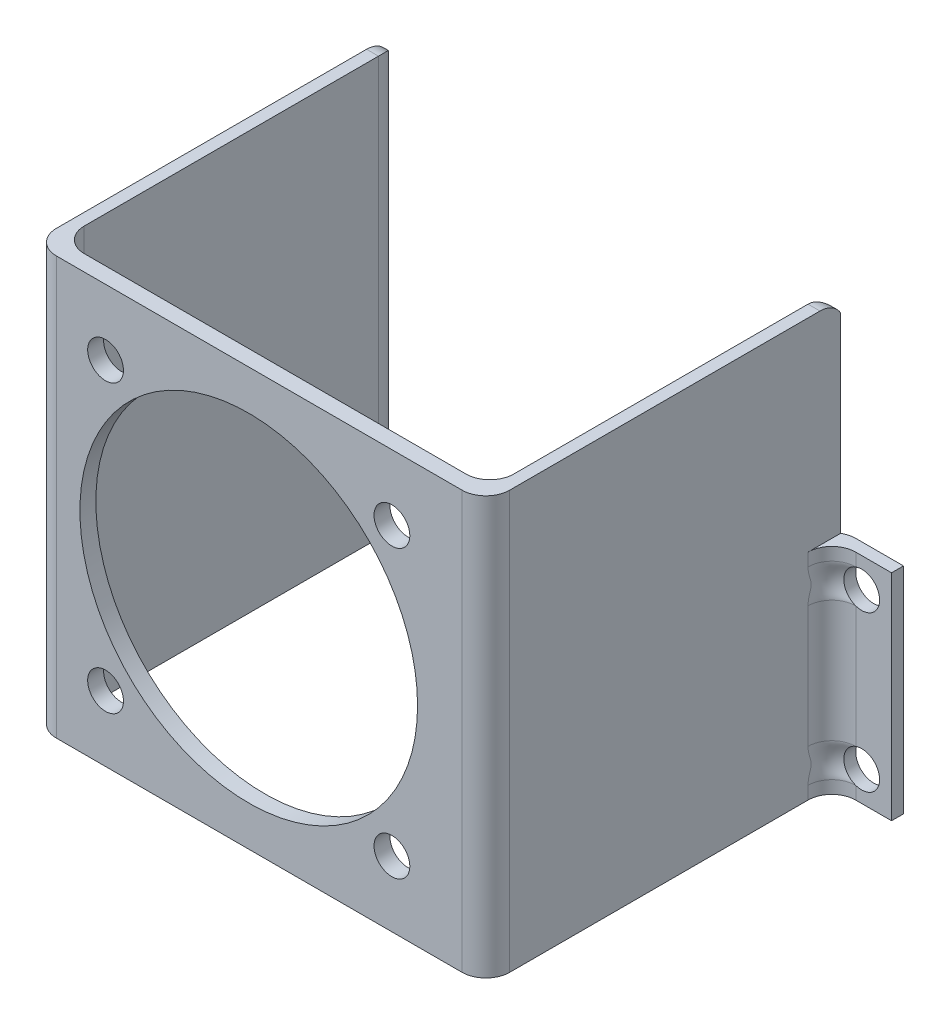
SolidWorks part; units mm, degrees
ref_plane "Front Plane" through (0, 0, 0) normal (0, 0, 1) x (1, 0, 0)
ref_plane "Top Plane" through (0, 0, 0) normal (0, 1, 0) x (1, 0, 0)
ref_plane "Right Plane" through (0, 0, 0) normal (1, 0, 0) x (0, 0, -1)
sketch "Sketch1" plane through (0, 0, 0) normal (0, 0, 1) x (1, 0, 0)
  line L0 (26, -6.514) -> (26, 6.514) construction
  line L1 (-17, -6.514) -> (-17, 6.514) construction
  line L3 (23.5, -9) -> (28.5, -9)
  line L4 (23.5, -9) -> (23.5, 9)
  line L5 (23.5, 9) -> (28.5, 9)
  line L6 (28.5, -9) -> (28.5, 9)
  line L7 (23.5, -9) -> (28.5, 9) construction
  line L8 (23.5, 9) -> (28.5, -9) construction
  line L9 (4.5, 200010.514) -> (4.5, -200005.4786)
  line L10 (-19.5, -9) -> (-19.5, 9)
  line L11 (-14.5, -9) -> (-19.5, -9)
  line L12 (-14.5, -9) -> (-14.5, 9)
  line L13 (-14.5, 9) -> (-19.5, 9)
  circle A4 centre (-17, -6.514) radius 1.5
  circle A5 centre (-17, 6.514) radius 1.5
  circle A6 centre (26, -6.514) radius 1.5
  circle A7 centre (26, 6.514) radius 1.5
  point P12 (26, 0)
  dimension "D1" = 5
  dimension "D2" = 18
extrude "Boss-Extrude1" add sketch "Sketch1" along normal blind 1
sketch "Sketch2" plane through (0, -9, 0) normal (0, 1, 0) x (1, 0, 0)
  line L0 (23.5, -1) -> (23.5, 0) construction
  line L1 (23.5, -1) -> (23.5, 0)
  line L2 (4.5, 12.0037) -> (4.5, -55.4766) construction
  line L3 (23.5, 0) -> (22.5, 0)
  line L4 (23.5, 0) -> (23.5, -30)
  line L5 (23.5, -30) -> (22.5, -30)
  line L6 (22.5, 0) -> (22.5, -28.6639)
  line L7 (22.5, -30) -> (-13.5, -30)
  line L8 (22.5, -30) -> (22.5, -28.6639) construction
  line L9 (22.5, -28.6639) -> (-13.5, -28.6639)
  line L10 (4.5, -30) -> (4.5, -28.6639)
  line L11 (-13.5, -30) -> (-13.5, -28.6639) construction
  line L12 (-13.5, 0) -> (-13.5, -28.6639)
  line L13 (-14.5, -30) -> (-13.5, -30)
  line L14 (-14.5, -1) -> (-14.5, 0) construction
  line L15 (-14.5, 0) -> (-14.5, -30)
  line L16 (-13.5, 0) -> (-14.5, 0)
  line L17 (22.5, -28.6639) -> (22.5, -30) construction
  line L18 (-13.5, -28.6639) -> (-13.5, -30) construction
  dimension "D1" = 1
  dimension "D2" = 30
extrude "Boss-Extrude2" add sketch "Sketch2" along normal blind 35 contours L3 L6 L9 L12 L16 L15 L13 L7 L5 L4
sketch "Sketch4" plane through (0, 0, 30) normal (0, 0, 1) x (1, 0, 0)
  circle A0 centre (15.625, 20.5) radius 1.5
  circle A1 centre (-8.375, 20.5) radius 1.5
  circle A4 centre (-8.375, -3.5) radius 1.5
  circle A5 centre (15.625, -3.5) radius 1.5
  circle A6 centre (3.625, 8.5) radius 16.9706 construction
  circle A7 centre (3.625, 8.5) radius 14.15
  dimension "D1" = 3
  dimension "D2" = 3
  dimension "D3" = 3
  dimension "D4" = 3
extrude "Cut-Extrude1" cut sketch "Sketch4" against normal up to next
fillet "Fillet1" radius 2 8 edges at (-14.5, 0, 1) (23.5, 0, 1) (-13.5, 8.5, 28.6639) (-14.5, 8.5, 30) (23.5, 8.5, 30) (22.5, 8.5, 28.6639) (-14, 26, 0) (23, 26, 0)
sketch "Sketch5" plane through (0, -9, 0) normal (0, -1, 0) x (1, 0, 0)
  line L0 (-13.5, 0) -> (-13.5, 26.6639) construction
  line L1 (-13.5, 0) -> (-19.5, 0) construction
  line L2 (-13.5, 0) -> (-13.5, 26.6639)
  line L3 (-13.5, 0) -> (-19.5, 0)
  line L4 (22.5, 0) -> (22.5, 26.6639) construction
  line L5 (22.5, 0) -> (22.5, 26.6639)
  line L6 (4.5, 26.0123) -> (4.5, 43.2732) construction
  line L7 (22.5, 0) -> (28.5, 0) construction
  line L8 (22.5, 0) -> (28.5, 0)
  arc A0 (-16.5, 1) -> (-14.5, 3) centre (-16.5, 3) ccw construction
  arc A1 (-16.5, 1) -> (-14.5, 3) centre (-16.5, 3) ccw
  arc A2 (-15.5, 0) -> (-13.5, 2) centre (-15.5, 2) ccw
  arc A3 (-13.5, 2) -> (-15.5, 0) centre (-15.5, 2) ccw construction
  arc A4 (24.5, 0) -> (22.5, 2) centre (24.5, 2) cw
  point P12 (-14.0858, 0.5858)
  point P17 (23.0858, 0.5858)
  dimension "D1" = 4
extrude "Cut-Extrude2" cut sketch "Sketch5" against normal blind 40 contours A2 L3 M11 | A4 L5 M16
